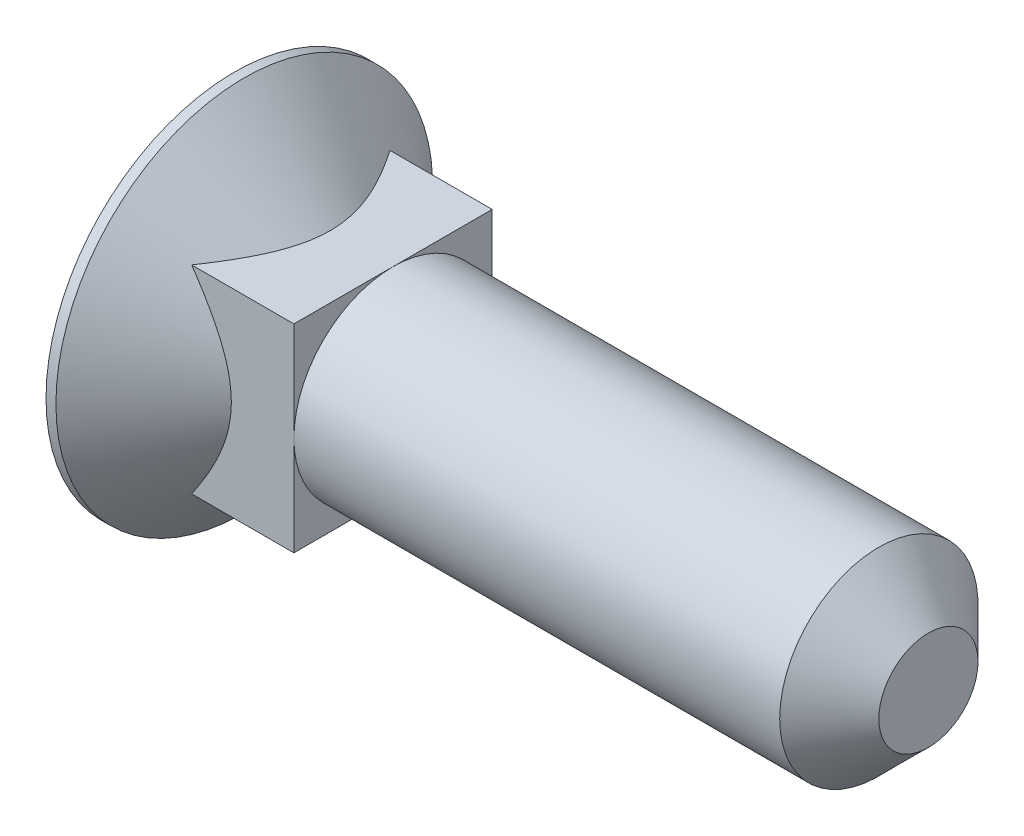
SolidWorks part; units mm, degrees
ref_plane "Front Plane" through (0, 0, 0) normal (0, 0, 1) x (1, 0, 0)
ref_plane "Top Plane" through (0, 0, 0) normal (0, 1, 0) x (1, 0, 0)
ref_plane "Right Plane" through (0, 0, 0) normal (1, 0, 0) x (0, 0, -1)
sketch "BodySke" plane through (0, 0, 0) normal (0, 0, 1) x (1, 0, 0)
  line L0 (0, 0) -> (44.1549, 0) construction
  line L1 (0, 0) -> (0, 9.5)
  line L2 (0, 9.5) -> (0.5, 9.5)
  line L3 (0.5, 9.5) -> (4.8456, 5)
  line L4 (4.8456, 5) -> (32.5, 5)
  line L5 (32.5, 5) -> (35, 2.5)
  line L6 (35, 2.5) -> (35, 0)
  line L7 (35, 0) -> (0, 0)
  line L8 (0, -9.5) -> (0.5, -9.5) construction
  line L9 (0.5, -9.5) -> (4.8456, -5) construction
  line L10 (8, 5) -> (8, 0) construction
  line L11 (33.5, 0) -> (33.5, 5) construction
  point P16 (0, 4.172)
  dimension "Head_diameter" = 19
  dimension "Head_Angle" = 92
  dimension "Diameter" = 10
  dimension "Length" = 35
  dimension "Chamfer_angle" = 45
  dimension "Depth_Chamfer" = 2.5
  dimension "Head_height" = 0.5
  dimension "Thread_length" = 27
  dimension "Advance" = 1.5
  dimension "Thread_minor" = 8.344
revolve "BaseBody" add sketch "BodySke" angle 360 about L0
sketch "SquareSke" plane through (0, 0, 0) normal (1, 0, 0) x (0, 0, -1)
  line L0 (-5, 5) -> (5, -5) construction
  line L1 (-5, 5) -> (5, 5)
  line L2 (-5, 5) -> (-5, -5)
  line L3 (-5, -5) -> (5, -5)
  line L4 (5, 5) -> (5, -5)
  dimension "D1" = 10
extrude "Square" add sketch "SquareSke" along normal blind 8
sketch "ThdSchSke" plane through (0, 0, 0) normal (0, 0, 1) x (1, 0, 0)
  line L0 (0, 0) -> (40.6405, 0) construction
  line L1 (0, 9.5) -> (0, -9.5) construction
  line L2 (31, 5.9561) -> (31, 5)
  line L3 (31, 5.9561) -> (31.9561, 5.9561)
  line L4 (31.9561, 5.9561) -> (31.9561, 5)
  line L5 (31.9561, 5) -> (31.478, 4.172)
  line L6 (31.478, 4.172) -> (31, 5)
  line L8 (4.8456, 5) -> (32.5, 5) construction
  dimension "D1" = 1.5
revolve "ThreadSchematic" [suppressed] cut sketch "ThdSchSke" angle 360 about L0
pattern_linear "ThdSchPat" [suppressed]
equation "\"Thread_minor@ThreadCosmetic\" = \"Thread_minor@BodySke\""
equation "\"D1@ThdSchSke\" = \"Advance@BodySke\""
equation "\"Advance@ThdSchPat\" = \"Advance@BodySke\""
equation "\"Teeth_Num@ThdSchPat\" =  int( (  \"Thread_length@BodySke\"  - \"Depth_Chamfer@BodySke\" ) / \"Advance@BodySke\" )"
equation "\"D1@SquareSke\" = \"Diameter@BodySke\""
